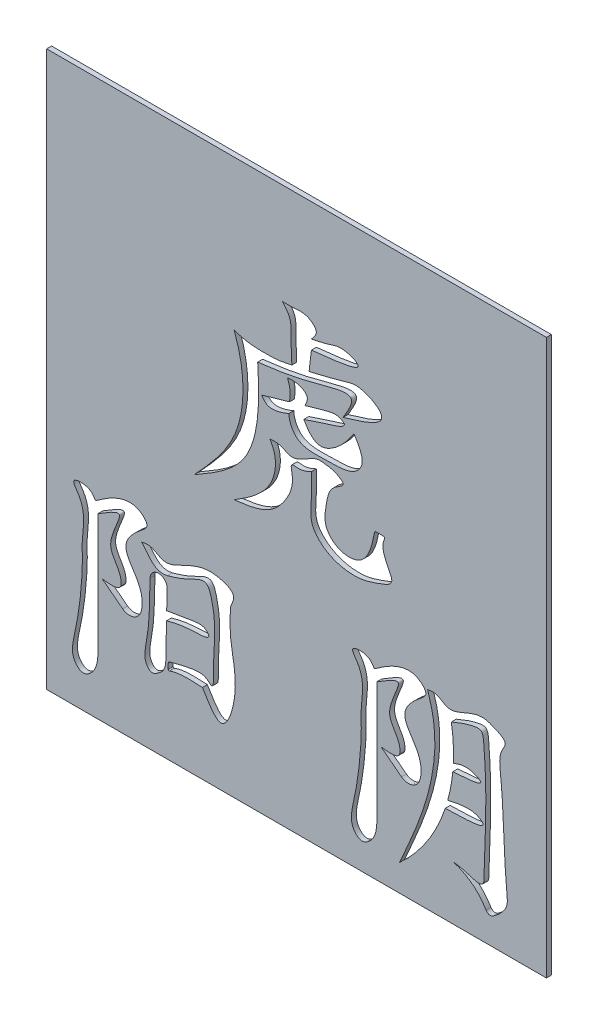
SolidWorks part; units mm, degrees
ref_plane "Vorne" through (0, 0, 0) normal (0, 0, 1) x (1, 0, 0)
ref_plane "Oben" through (0, 0, 0) normal (0, 1, 0) x (1, 0, 0)
ref_plane "Rechts" through (0, 0, 0) normal (1, 0, 0) x (0, 0, -1)
sketch "Skizze1" plane through (0, 0, 0) normal (0, 0, 1) x (1, 0, 0)
  line L1 (0, 0) -> (101.5154, 0)
  line L2 (0, 0) -> (0, 112.7201)
  line L3 (0, 112.7201) -> (101.5154, 112.7201)
  line L4 (101.5154, 0) -> (101.5154, 112.7201)
extrude "Linear austragen1" add sketch "Skizze1" along normal blind 1
sketch "Skizze2"
sketch "Skizze4" plane through (0, 0, 1) normal (0, 0, 1) x (1, 0, 0)
  line L0 (10.4079, 11.8265) -> (10.4079, 36.1451)
  line L1 (11.2902, 25.1162) -> (15.426, 21.9179)
  line L2 (24.5066, 32.2853) -> (24.3778, 26.0444)
  line L3 (24.341, 24.2597) -> (24.1935, 17.1161)
  point P0 (9.9116, 38.1854)
  point P1 (8.6433, 39.564)
  point P3 (5.5001, 39.3986)
  point P5 (6.3824, 37.6891)
  point P7 (7.2095, 28.7557)
  point P8 (16.3083, 41.3286)
  point P9 (5.6655, 12.5985)
  point P10 (14.7092, 38.1854)
  point P11 (5.7758, 7.7458)
  point P12 (18.459, 41.0529)
  point P13 (7.2647, 6.6429)
  point P14 (19.2861, 35.5936)
  point P15 (8.9742, 7.4149)
  point P16 (20.3339, 38.8471)
  point P18 (12.9997, 32.0092)
  point P19 (19.2861, 37.6891)
  point P20 (20.9956, 32.0092)
  point P21 (16.0878, 33.1673)
  point P22 (14.8746, 27.6529)
  point P23 (18.2384, 28.7557)
  point P24 (20.9956, 35.7039)
  point P25 (19.3964, 25.1162)
  point P26 (14.9991, 25.639)
  point P27 (18.2384, 21.9179)
  point P28 (20.775, 22.8553)
  point P30 (19.9479, 16.1277)
  point P31 (23.7528, 34.5459)
  point P32 (21.3265, 13.7014)
  point P34 (23.7528, 15.08)
  point P35 (27.4475, 35.5936)
  point P36 (27.4475, 16.238)
  point P37 (37.7513, 25.1162)
  point P38 (31.6384, 16.1829)
  point P39 (33.5133, 37.3582)
  point P41 (35.1125, 37.1377)
  point P42 (29.8539, 26.9552)
  point P43 (37.98, 35.1525)
  point P45 (37.3734, 33.1673)
  point P46 (32.4371, 26.6133)
  point P47 (38.2006, 18.0026)
  point P49 (35.4434, 11.8265)
  point P50 (32.893, 26.0444)
  point P51 (28.7845, 33.8243)
  point P52 (29.6294, 25.1417)
  point P55 (32.4371, 34.8289)
  point P57 (33.5133, 32.5631)
  point P59 (33.872, 19.3099)
  point P61 (33.5133, 17.4075)
  point P63 (32.6749, 18.0026)
  point P65 (30.0456, 18.4549)
extrude "Schnitt-Linear austragen2" cut sketch "Skizze4" against normal through all
sketch "Skizze8" plane through (54.4441, -2.1064, 1) normal (0, 0, 1) x (1, 0, 0)
  line L0 (12.6276, 12.6865) -> (12.6276, 37.0051)
  line L1 (13.5099, 25.9762) -> (17.6457, 22.7779)
  arc A0 (27.764, 37.4966) -> (28.1695, 30.4255) centre (-4.7681, 32.0836) cw
  arc A1 (28.2112, 13.0627) -> (34.8114, 7.916) centre (25.164, 2.3495) cw
  arc A2 (34.8114, 7.916) -> (36.2701, 7.6103) centre (35.6775, 8.4157) ccw
  arc A3 (26.5328, 21.6967) -> (17.2188, 7.5029) centre (-4.7681, 32.0836) cw
  arc A4 (28.0563, 28.8905) -> (27.0305, 23.3382) centre (-4.7681, 32.0836) cw
  point P0 (22.9482, 40.7916)
  point P1 (10.863, 40.424)
  point P2 (23.962, 37.0051)
  point P3 (7.7197, 40.2586)
  point P5 (8.602, 38.5491)
  point P6 (23.8099, 25.9762)
  point P7 (9.4292, 29.6157)
  point P8 (18.528, 42.1886)
  point P9 (7.8852, 13.4585)
  point P10 (16.9288, 39.0454)
  point P11 (7.9955, 8.6058)
  point P12 (20.6786, 41.9129)
  point P13 (9.4844, 7.5029)
  point P15 (11.1938, 8.2749)
  point P16 (22.5535, 39.7071)
  point P18 (15.2193, 32.8693)
  point P19 (21.5058, 38.5491)
  point P21 (18.3074, 34.0273)
  point P22 (17.0942, 28.5129)
  point P23 (20.458, 29.6157)
  point P25 (21.6161, 25.9762)
  point P26 (17.2188, 26.499)
  point P27 (20.458, 22.7779)
  point P31 (32.442, 39.0454)
  point P32 (24.621, 40.8423)
  point P34 (33.6443, 39.0454)
  point P36 (34.354, 37.0051)
  point P37 (26.9022, 39.7071)
  point P39 (34.4047, 13.4585)
  point P40 (12.1313, 39.0454)
  point P42 (34.2526, 12.353)
  point P43 (30.3493, 40.424)
  point P44 (30.3493, 12.6865)
  point P46 (34.354, 41.4506)
  point P47 (31.188, 30.9979)
  point P48 (36.5845, 40.7916)
  point P50 (38.7136, 39.0454)
  point P51 (33.6443, 30.0746)
  point P52 (38.156, 37.8514)
  point P53 (31.5649, 23.9649)
  point P54 (37.7504, 33.2891)
  point P56 (39.0685, 12.6865)
  point P57 (34.0212, 23.0416)
  point P58 (39.1191, 11.3391)
  dimension "D1" = 1
extrude "Schnitt-Linear austragen3" cut sketch "Skizze8" against normal through all
sketch "Skizze5" plane through (0, 0, 1) normal (0, 0, 1) x (1, 0, 0)
  line L0 (24.341, 24.2597) -> (24.1935, 17.1161) construction
  line L1 (24.6745, 17.2526) -> (24.6745, 15.608)
  line L2 (24.5066, 32.2853) -> (24.3778, 26.0444) construction
  line L3 (24.5066, 32.2853) -> (24.4602, 30.0353)
  arc A0 (24.4602, 30.0353) -> (20.9998, 30.0842) centre (22.7301, 30.071) ccw
  point P0 (24.1935, 17.1161)
  point P4 (19.2861, 35.5936)
  point P5 (31.6384, 16.1829)
  point P10 (24.5066, 32.2853)
  point P13 (23.1745, 14.6401)
  dimension "D1" = 0.5
  dimension "D2" = 1.5
  dimension "D3" = 2.25
extrude "Linear austragen2" add sketch "Skizze5" against normal up to vertex
fillet "Verrundung1" radius 0.5 1 edges
fillet "Verrundung2" radius 0.2 1 edges
sketch "Skizze3" plane through (0, 0, 1) normal (0, 0, 1) x (1, 0, 0)
  line L0 (56.1576, 77.2591) -> (52.4865, 76.197)
  line L1 (49.338, 75.2861) -> (43.6742, 73.6475)
  line L2 (66.8997, 61.1882) -> (68.3669, 61.1882)
  arc A0 (68.6291, 60.7425) -> (68.3669, 61.1882) centre (68.3669, 60.8882) ccw
  arc A1 (66.6051, 60.945) -> (66.8997, 61.1882) centre (66.8997, 60.8882) cw
  point P0 (38.0788, 82.2936)
  point P1 (38.788, 80.1657)
  point P2 (42.8643, 79.0382)
  point P3 (38.4411, 64.5546)
  point P4 (42.7775, 68.8043)
  point P5 (29.9418, 52.7596)
  point P6 (40.6037, 81.6093)
  point P7 (40.4359, 61.2589)
  point P8 (49.6291, 87.711)
  point P9 (44.0174, 81.3402)
  point P10 (49.8025, 92.215)
  point P11 (49.8025, 81.987)
  point P12 (49.4556, 89.7925)
  point P13 (57.5365, 89.4478)
  point P14 (47.8945, 92.2209)
  point P15 (52.822, 92.1125)
  point P16 (61.0774, 84.6032)
  point P17 (54.7693, 90.2677)
  point P18 (59.3471, 89.9261)
  point P19 (53.7786, 88.5596)
  point P20 (53.3003, 82.5941)
  point P21 (63.0025, 88.9696)
  point P22 (61.9145, 81.987)
  point P23 (53.7786, 86.6123)
  point P24 (62.1824, 84.8727)
  point P25 (48.9273, 79.3113)
  point P26 (67.9753, 82.3279)
  point P27 (54.8827, 81.2564)
  point P28 (60.2068, 77.9749)
  point P29 (51.2041, 79.2066)
  point P31 (52.9052, 77.9749)
  point P34 (49.3442, 77.9749)
  point P35 (60.8213, 74.035)
  point P36 (49.2077, 73.1621)
  point P37 (57.2333, 77.5212)
  point P38 (45.3637, 66.7464)
  point P39 (58.0222, 71.4903)
  point P40 (46.1031, 65.2215)
  point P41 (44.4791, 72.6808)
  point P42 (55.2994, 70.676)
  point P43 (53.7786, 65.2215)
  point P44 (59.778, 77.4448)
  point P45 (45.872, 59.9074)
  point P46 (53.7786, 71.5158)
  point P47 (50.8626, 64.4821)
  point P49 (62.4499, 76.197)
  point P50 (52.2458, 73.6475)
  point P51 (60.4905, 76.8596)
  point P52 (47.5918, 72.561)
  point P53 (57.1061, 75.231)
  point P54 (38.0788, 52.4215)
  point P55 (46.6576, 66.7926)
  point P56 (49.8025, 64.4359)
  point P57 (53.7738, 60.5653)
  point P58 (49.3442, 72.1338)
  point P59 (50.9603, 69.5943)
  point P60 (56.1576, 68.7222)
  point P61 (58.4039, 68.7675)
  point P62 (63.1115, 70.0907)
  point P63 (63.9004, 71.2104)
  point P64 (49.8025, 63.1883)
  point P65 (48.2749, 66.3305)
  point P66 (49.2077, 58.8908)
  point P68 (45.3637, 54.3623)
  point P69 (49.7924, 65.8222)
  point P70 (54.0049, 55.8872)
  point P71 (51.1861, 66.1457)
  point P73 (53.3003, 67.2547)
  point P74 (55.7608, 53.5767)
  point P75 (54.7904, 67.9478)
  point P77 (56.7312, 67.9478)
  point P78 (59.8273, 51.5897)
  point P79 (58.9493, 67.3471)
  point P81 (60.2068, 66.2843)
  point P82 (63.7089, 51.3586)
  point P83 (58.672, 64.9442)
  point P85 (56.8237, 61.155)
  point P86 (67.5904, 52.4215)
  point P87 (56.8237, 56.95)
  point P89 (59.5962, 54.3623)
  point P90 (70.0858, 54.0388)
  point P91 (63.2006, 54.3623)
  point P94 (69.4388, 55.9796)
  dimension "D1" = 0.3
extrude "Schnitt-Linear austragen1" cut sketch "Skizze3" against normal through all
